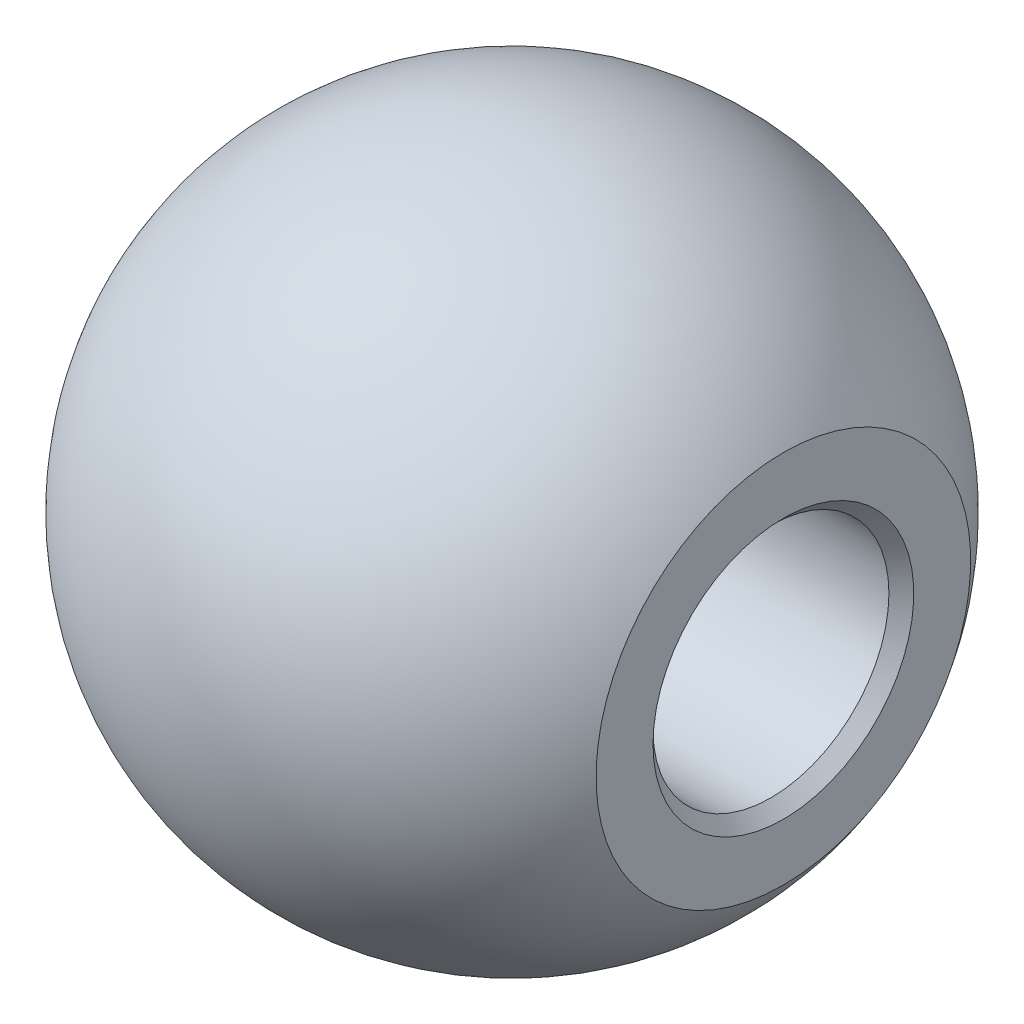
SolidWorks part; units mm, degrees
ref_plane "Front Plane" through (0, 0, 0) normal (0, 0, 1) x (1, 0, 0)
ref_plane "Top Plane" through (0, 0, 0) normal (0, 1, 0) x (1, 0, 0)
ref_plane "Right Plane" through (0, 0, 0) normal (1, 0, 0) x (0, 0, -1)
sketch "Sketch1" plane through (0, 0, 0) normal (0, 0, 1) x (1, 0, 0)
  line L0 (0, 0) -> (5.5499, 0) construction
  line L1 (0, 2.413) -> (5.5499, 2.413)
  line L2 (5.5499, 2.413) -> (5.5499, 3.8309)
  line L3 (0, 2.413) -> (0, 6.7437)
  line L4 (0, 0) -> (0, 2.413) construction
  arc A0 (5.5499, 3.8309) -> (0, 6.7437) centre (0, 0) ccw
  dimension "Ball_Dia" = 13.4874
  dimension "B" = 4.826
  dimension "D2" = 7.6619
  dimension "W" = 11.0998
revolve "Revolve1" add sketch "Sketch1" angle 360 about L0
chamfer "Chamfer1" distance 0.254 angle 45 1 edges at (5.5499, 0, 2.413)
mirror "Mirror1" about plane through (0, 0, 0) normal (1, 0, 0)
